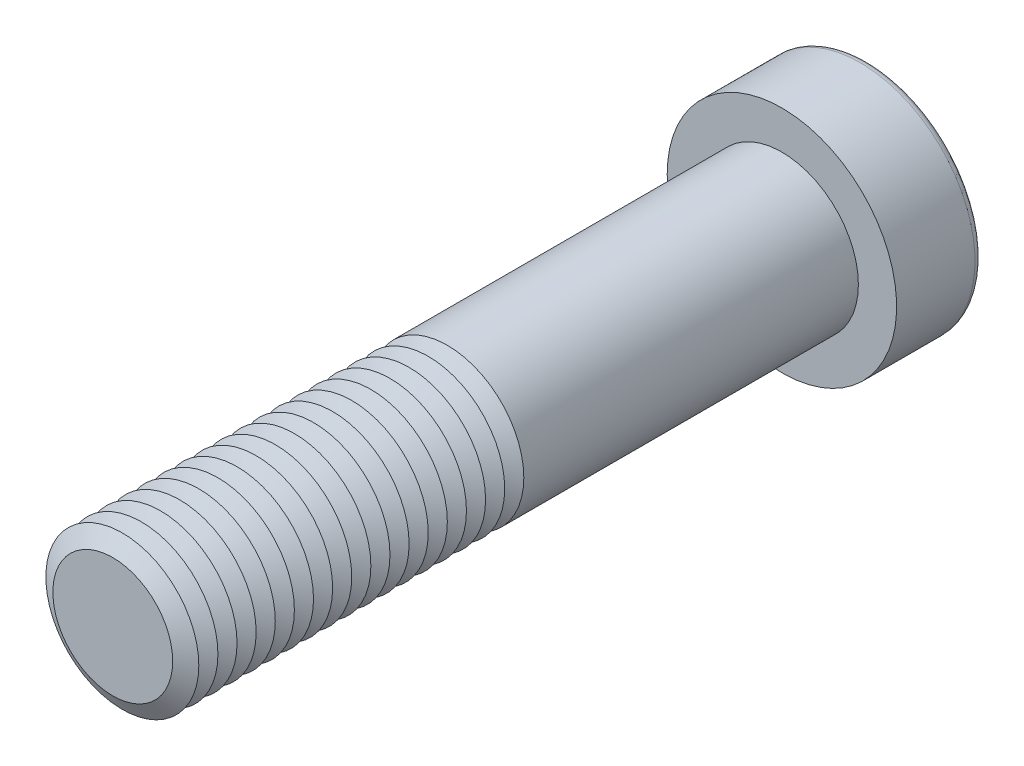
SolidWorks part; units mm, degrees
ref_plane "Front Plane" through (0, 0, 0) normal (0, 0, 1) x (1, 0, 0)
ref_plane "Top Plane" through (0, 0, 0) normal (0, 1, 0) x (1, 0, 0)
ref_plane "Right Plane" through (0, 0, 0) normal (1, 0, 0) x (0, 0, -1)
sketch "Sketch1" plane through (0, 0, 0) normal (0, 0, 1) x (1, 0, 0)
  circle A0 centre (0, 0) radius 8
  dimension "D1" = 16
extrude "Boss-Extrude1" add sketch "Sketch1" along normal blind 70
sketch "Sketch2" plane through (0, 0, 0) normal (0, 0, -1) x (-1, 0, 0)
  circle A0 centre (0, 0) radius 12
  dimension "D1" = 24
extrude "Boss-Extrude2" add sketch "Sketch2" along normal blind 9
sketch "Sketch3" plane through (0, 0, -9) normal (0, 0, -1) x (-1, 0, 0)
  line L1 (-3.4641, 6) -> (-6.9282, 0)
  line L2 (-6.9282, 0) -> (-3.4641, -6)
  line L3 (-3.4641, -6) -> (3.4641, -6)
  line L4 (3.4641, -6) -> (6.9282, 0)
  line L5 (6.9282, 0) -> (3.4641, 6)
  line L6 (3.4641, 6) -> (-3.4641, 6)
  circle A0 centre (0, 0) radius 6 construction
  dimension "D1" = 12
extrude "Cut-Extrude1" cut sketch "Sketch3" against normal blind 9
fillet "Fillet1" radius 0.8 1 edges at (-12, 0, -9)
sketch "Sketch4" plane through (0, 0, 0) normal (0, 0, -1) x (-1, 0, 0)
  line L0 (3.4641, -6) -> (6.9282, 0) construction
  circle A0 centre (0, 0) radius 6
extrude "Cut-Extrude2" cut sketch "Sketch4" against normal through all draft 60
sketch "Sketch5" plane through (0, 0, -9) normal (0, 0, -1) x (-1, 0, 0)
  circle A0 centre (0, 0) radius 6.9282
extrude "Cut-Extrude3" cut sketch "Sketch5" against normal through all draft 75
sketch "Sketch7" plane through (0, 0, 0) normal (1, 0, 0) x (0, 0, -1)
  line L25 (-70, 6.2679) -> (-69, 8)
  line L26 (-70, 8) -> (-70, -8) construction
  line L27 (-69, 8) -> (-71, 8)
  line L28 (-71, 8) -> (-70, 6.2679)
  line L29 (0, 8) -> (-70, 8) construction
  dimension "D1" = 2
revolve "Cut-Revolve1" cut sketch "Sketch7" angle 360 about axis through (0, 0, 70) along (0, 0, -1)
pattern_linear "LPattern1" count 18 spacing 2 along (0, 0, -1) of "Cut-Revolve1"
